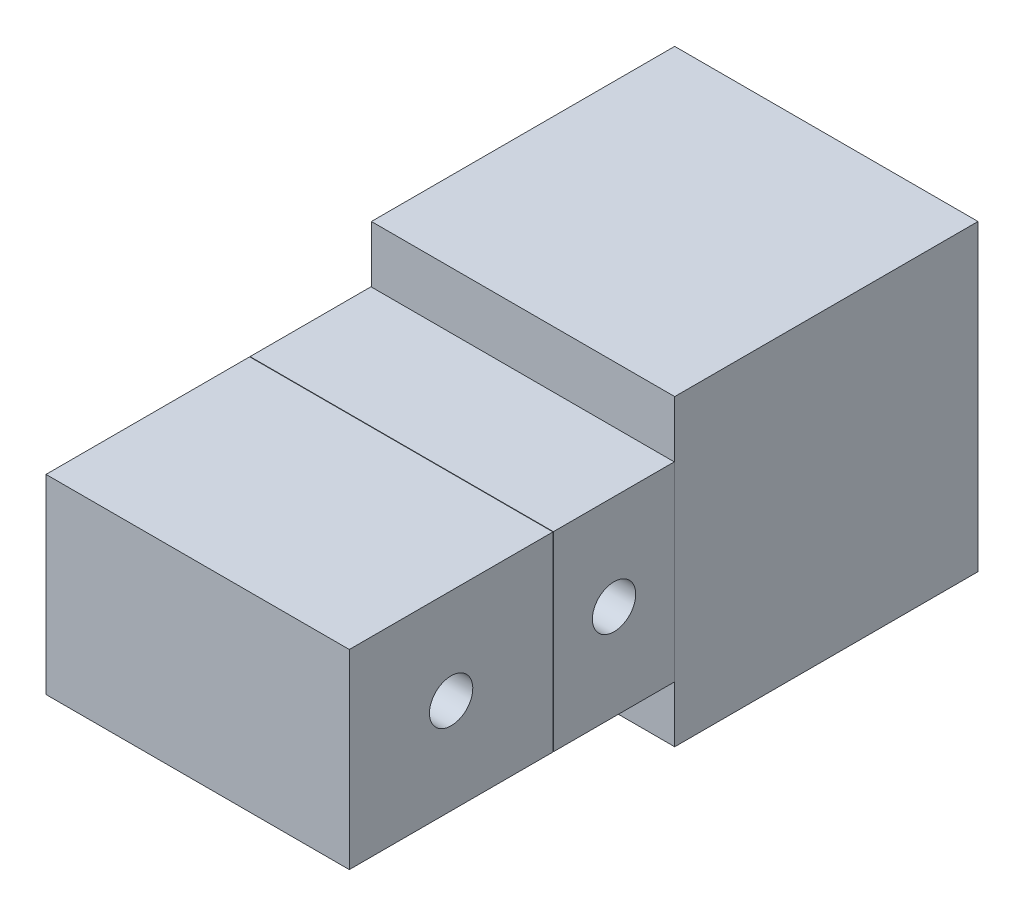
SolidWorks part; units mm, degrees
ref_plane "Plan de face" through (0, 0, 0) normal (0, 0, 1) x (1, 0, 0)
ref_plane "Plan de dessus" through (0, 0, 0) normal (0, 1, 0) x (1, 0, 0)
ref_plane "Plan de droite" through (0, 0, 0) normal (1, 0, 0) x (0, 0, -1)
sketch "Esquisse1" plane through (0, 0, 0) normal (0, 0, 1) x (1, 0, 0)
  line L0 (-35, 35) -> (35, -35) construction
  line L1 (-35, 35) -> (35, 35)
  line L2 (-35, 35) -> (-35, -35)
  line L3 (-35, -35) -> (35, -35)
  line L4 (35, 35) -> (35, -35)
  dimension "D1" = 70
  dimension "D2" = 70
extrude "Extrusion1" add sketch "Esquisse1" along normal blind 70
sketch "Esquisse2" plane through (0, 0, 70) normal (0, 0, 1) x (1, 0, 0)
  line L0 (-35, 35) -> (-35, -35) construction
  line L1 (35, -35) -> (35, 35) construction
  line L16 (-35, 22) -> (-35, -22)
  line L17 (-35, -22) -> (35, -22)
  line L18 (35, -22) -> (35, 22)
  line L19 (35, 22) -> (-35, 22)
  dimension "D1" = 44
  dimension "D2" = 22
extrude "Extrusion2" add sketch "Esquisse2" along normal blind 27.9 from offset 0.1
sketch "Esquisse4" plane through (0, 0, 0) normal (0, 0, -1) x (-1, 0, 0)
  line L0 (0, 0) -> (0, 41.8726) construction
  line L1 (0, 0) -> (28.7361, 0) construction
  circle A0 centre (-19, 17) radius 4
  circle A1 centre (19, 17) radius 4
  circle A2 centre (19, -17) radius 4
  circle A3 centre (-19, -17) radius 4
  dimension "D2" = 34
  dimension "D3" = 8
  dimension "D1" = 38
extrude "Enlèv. mat.-Extru.1" cut sketch "Esquisse4" against normal blind 30
sketch "Esquisse5" plane through (0, 0, 98) normal (0, 0, 1) x (1, 0, 0)
  line L0 (-35, 22) -> (35, 22)
  line L1 (35, 22) -> (35, -22)
  line L2 (35, -22) -> (-35, -22)
  line L3 (-35, -22) -> (-35, 22)
extrude "Extrusion3" add sketch "Esquisse5" along normal blind 47 from offset 0.1
sketch "Esquisse6" plane through (0, -35, 0) normal (0, 1, 0) x (-1, 0, 0)
  line L0 (-35, 0) -> (35, 0) construction
  circle A0 centre (20, 35) radius 5
  circle A1 centre (-20, 35) radius 5
  dimension "D5" = 10
  dimension "D1" = 40
  dimension "D2" = 20
  dimension "D3" = 35
  dimension "D4" = 35
extrude "Enlèv. mat.-Extru.2" cut sketch "Esquisse6" along normal blind 10
sketch "Esquisse7" plane through (-35, 0, 0) normal (1, 0, 0) x (0, 0, -1)
  line L0 (0, -35) -> (0, 35) construction
  circle A0 centre (-15, 0) radius 5
  circle A1 centre (-55, 0) radius 5
  dimension "D3" = 10
  dimension "D1" = 40
  dimension "D2" = 15
extrude "Enlèv. mat.-Extru.3" cut sketch "Esquisse7" along normal blind 10
sketch "Esquisse8" plane through (-35, 0, 0) normal (-1, 0, 0) x (0, 0, 1)
  line L0 (70, 35) -> (70, -35) construction
  circle A0 centre (84, 0) radius 5
  dimension "D1" = 10
  dimension "D2" = 14
extrude "Enlèv. mat.-Extru.4" cut sketch "Esquisse8" against normal through all
sketch "Esquisse9" plane through (-35, 0, 0) normal (-1, 0, 0) x (0, 0, 1)
  line L0 (145.1, 22) -> (145.1, -22) construction
  circle A0 centre (121.6, 0) radius 5
  dimension "D1" = 10
  dimension "D2" = 23.5
extrude "Enlèv. mat.-Extru.5" cut sketch "Esquisse9" against normal through all
sketch "Esquisse10" plane through (0, 0, 0) normal (0, 0, -1) x (-1, 0, 0)
  line L0 (35, -35) -> (-35, -35) construction
  circle A0 centre (0, 29) radius 2.5
  circle A1 centre (0, -29) radius 2.5
  dimension "D3" = 5
  dimension "D1" = 58
  dimension "D2" = 6
extrude "Enlèv. mat.-Extru.6" cut sketch "Esquisse10" against normal blind 10
hole_wizard "Trou taraudé M81" positions "Esquisse3D1" profile "Esquisse11" tap size "M8" standard "ISO"
sketch3d "Esquisse3D1"
  point P0 (27.5, -35, 7.5)
  point P2 (-27.5, -35, 7.5)
  point P4 (-27.5, -35, 62.5)
  point P6 (27.5, -35, 62.5)
  dimension "D1" = 55
  dimension "D2" = 55
  dimension "D3" = 7.5
  dimension "D4" = 7.5
sketch "Esquisse11" plane through (27.5, -35, 7.5) normal (1, 0, 0) x (0, 0, -1)
  line L0 (0, 0) -> (0, 24.2929)
  line L1 (0, 24.2929) -> (3.4, 22.25)
  line L2 (3.4, 22.25) -> (3.4, 1.1)
  line L3 (3.4, 1.1) -> (4.5, 0)
  line L5 (4.5, 0) -> (0, 0)
  line L6 (-3.4, 1.1) -> (-4.5, 0) construction
  line L10 (0, 24.2929) -> (-3.4, 22.25) construction
  line L11 (0, -6.35) -> (0, 107.95) construction
  dimension "Diamètre du trou pour taraudage" = 6.8
  dimension "Profondeur du trou pour taraudage" = 22.25
  dimension "Diamètre du fraisage entrant" = 9
  dimension "Angle du fraisage entrant" = 90
  dimension "Angle de pointe" = 118
